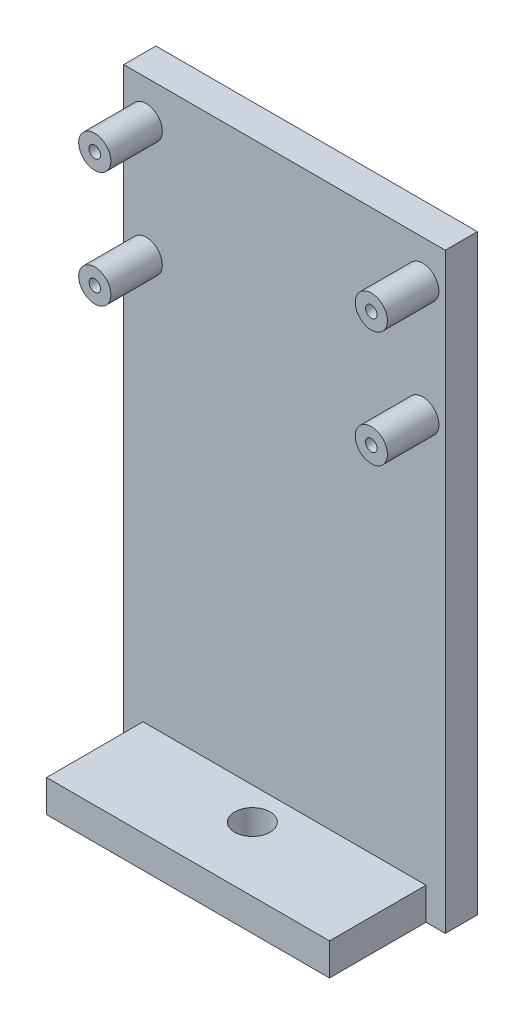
SolidWorks part; units mm, degrees
ref_plane "Piano frontale" through (0, 0, 0) normal (0, 0, 1) x (1, 0, 0)
ref_plane "Piano superiore" through (0, 0, 0) normal (0, 1, 0) x (1, 0, 0)
ref_plane "Piano destro" through (0, 0, 0) normal (1, 0, 0) x (0, 0, -1)
sketch "Schizzo1" plane through (0, 0, 0) normal (0, 0, 1) x (1, 0, 0)
  line L1 (-25, 46) -> (25, 46)
  line L2 (-25, 46) -> (-25, -46)
  line L3 (-25, -46) -> (25, -46)
  line L4 (25, 46) -> (25, -46)
  line L5 (-25, 46) -> (25, -46) construction
  line L6 (-25, -46) -> (25, 46) construction
  point P0 (0, 0)
extrude "Estrusione-Estrusione1" add sketch "Schizzo1" along normal blind 5
sketch "Schizzo2" plane through (0, 0, 0) normal (0, 0, -1) x (-1, 0, 0)
  line L0 (-25, 46) -> (25, 46) construction
  line L1 (-30.7122, 0) -> (28.988, 0) construction
  circle A0 centre (-20, 43) radius 1.1
  circle A1 centre (20, 43) radius 1.1
  circle A2 centre (20, -43) radius 1.1
  circle A3 centre (-20, -43) radius 1.1
extrude "Taglio-Estrusione1" [suppressed] cut sketch "Schizzo2" against normal through all
sketch "Schizzo3" [suppressed] plane through (0, 0, 0) normal (0, 0, -1) x (-1, 0, 0)
  line L0 (-30.1734, 0) -> (27.0483, 0) construction
  circle A0 centre (-20, 12) radius 2
  circle A1 centre (-20, -12) radius 2
  circle A2 centre (20, 12) radius 2
  circle A3 centre (20, -12) radius 2
  dimension "D1" = 4
  dimension "D2" = 2
extrude "Estrusione-Estrusione2" [suppressed] add sketch "Schizzo3" along normal blind 4
hole_wizard "Foro filettato M2-1" positions "Schizzo4" profile "Schizzo5" tap size "M2" standard "ISO"
sketch "Schizzo4" [suppressed] plane through (0, 0, 0) normal (0, 0, 1) x (1, 0, 0)
  point P0 (-20, 12)
  point P3 (-20, -12)
  point P6 (20, -12)
  point P9 (20, 12)
sketch "Schizzo5" plane through (-20, 12, 0) normal (1, 0, 0) x (0, -1, 0)
  line L0 (0, 0) -> (0, 4)
  line L1 (0, 4) -> (0.8, 4)
  line L2 (0.8, 4) -> (0.8, 0)
  line L5 (0.8, 0) -> (0, 0)
  line L11 (0, -6.35) -> (0, 107.95) construction
  dimension "Thru Tap Drill Dia." = 1.6
  dimension "Thru Tap Drill Depth" = 4
sketch "Schizzo6" plane through (0, 0, 5) normal (0, 0, 1) x (1, 0, 0)
  line L5 (-25, -46) -> (25, -46) construction
  line L6 (-22, -46) -> (22, -46)
  line L7 (-22, -46) -> (-22, -41)
  line L8 (-22, -41) -> (22, -41)
  line L9 (22, -46) -> (22, -41)
extrude "Estrusione-Estrusione3" add sketch "Schizzo6" along normal blind 15
hole_wizard "Foro per Vite M5-1" positions "Schizzo7" profile "Schizzo8" hole size "M5" standard "ISO"
sketch "Schizzo7" plane through (0, -41, 0) normal (0, 1, 0) x (1, 0, 0)
  point P0 (0, -10)
  dimension "D1" = 10
sketch "Schizzo8" plane through (0, -41, 10) normal (1, 0, 0) x (0, 0, 1)
  line L0 (0, 0) -> (0, 5)
  line L1 (0, 5) -> (2.75, 5)
  line L2 (2.75, 5) -> (2.75, 0)
  line L5 (2.75, 0) -> (0, 0)
  line L11 (0, -6.35) -> (0, 107.95) construction
  dimension "Thru Hole Dia." = 5.5
  dimension "Thru Hole Depth" = 5
hole_wizard "Foro per Vite M1.6-1" positions "Schizzo10" profile "Schizzo11" hole size "M1.6" standard "ISO"
sketch "Schizzo10" plane through (0, 0, 5) normal (0, 0, 1) x (1, 0, 0)
  line L0 (22, -41) -> (-22, -41) construction
  point P0 (-21.5, 40)
  point P2 (21.5, 40)
  point P4 (21.5, 22)
  point P6 (-21.5, 22)
sketch "Schizzo11" plane through (-21.5, 40, 5) normal (1, 0, 0) x (0, -1, 0)
  line L0 (0, 0) -> (0, 5)
  line L1 (0, 5) -> (0.9, 5)
  line L2 (0.9, 5) -> (0.9, 0)
  line L5 (0.9, 0) -> (0, 0)
  line L11 (0, -6.35) -> (0, 107.95) construction
  dimension "Thru Hole Dia." = 1.8
  dimension "Thru Hole Depth" = 5
sketch "Schizzo12" plane through (0, 0, 5) normal (0, 0, 1) x (1, 0, 0)
  circle A0 centre (-21.5, 40) radius 2.5
  circle A1 centre (-21.5, 22) radius 2.5
  circle A2 centre (21.5, 40) radius 2.5
  circle A3 centre (21.5, 22) radius 2.5
  dimension "D1" = 5
extrude "Estrusione-Estrusione4" add sketch "Schizzo12" along normal blind 8
hole_wizard "Foro per Vite M1.6-2" positions "Schizzo13" profile "Schizzo14" hole size "M1.6" standard "ISO"
sketch "Schizzo13" plane through (0, 0, 13) normal (0, 0, 1) x (1, 0, 0)
  point P0 (-21.5, 40)
  point P3 (21.5, 40)
  point P6 (21.5, 22)
  point P9 (-21.5, 22)
sketch "Schizzo14" plane through (-21.5, 40, 13) normal (1, 0, 0) x (0, -1, 0)
  line L0 (0, 0) -> (0, 8)
  line L1 (0, 8) -> (0.9, 8)
  line L2 (0.9, 8) -> (0.9, 0)
  line L5 (0.9, 0) -> (0, 0)
  line L11 (0, -6.35) -> (0, 107.95) construction
  dimension "Thru Hole Dia." = 1.8
  dimension "Thru Hole Depth" = 8
equation "\"D1@Schizzo2\"=2+0.1*2"
equation "\"D1@Schizzo1\"=72+5+20/2+5"
equation "\"D2@Schizzo6\"=44/2"
equation "\"D1@Schizzo10\"=43/2"
equation "\"D4@Schizzo10\"=72-18/2"
